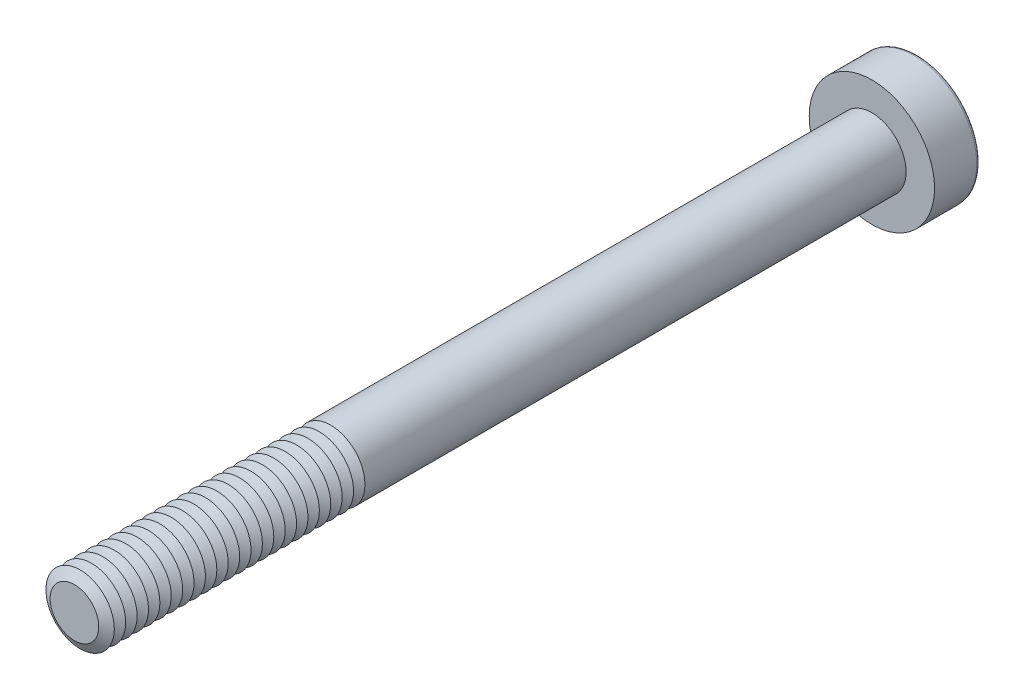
SolidWorks part; units mm, degrees
ref_plane "Front Plane" through (0, 0, 0) normal (0, 0, 1) x (1, 0, 0)
ref_plane "Top Plane" through (0, 0, 0) normal (0, 1, 0) x (1, 0, 0)
ref_plane "Right Plane" through (0, 0, 0) normal (1, 0, 0) x (0, 0, -1)
sketch "Sketch1" plane through (0, 0, 0) normal (0, 0, 1) x (1, 0, 0)
  circle A0 centre (0, 0) radius 1.5
  dimension "D1" = 3
extrude "Boss-Extrude1" add sketch "Sketch1" along normal blind 35
sketch "Sketch2" plane through (0, 0, 0) normal (0, 0, -1) x (-1, 0, 0)
  circle A0 centre (0, 0) radius 2.75
  dimension "D1" = 5.5
extrude "Boss-Extrude2" add sketch "Sketch2" along normal blind 2
sketch "Sketch3" plane through (0, 0, -2) normal (0, 0, -1) x (-1, 0, 0)
  line L1 (-0.5774, 1) -> (-1.1547, 0)
  line L2 (-1.1547, 0) -> (-0.5774, -1)
  line L3 (-0.5774, -1) -> (0.5774, -1)
  line L4 (0.5774, -1) -> (1.1547, 0)
  line L5 (1.1547, 0) -> (0.5774, 1)
  line L6 (0.5774, 1) -> (-0.5774, 1)
  circle A0 centre (0, 0) radius 1 construction
  dimension "D1" = 2
extrude "Cut-Extrude1" cut sketch "Sketch3" against normal blind 1.5
fillet "Fillet1" radius 0.15 1 edges at (-2.75, 0, -2)
sketch "Sketch4" plane through (0, 0, -0.5) normal (0, 0, -1) x (-1, 0, 0)
  line L0 (0.5774, -1) -> (1.1547, 0) construction
  circle A0 centre (0, 0) radius 1
extrude "Cut-Extrude2" cut sketch "Sketch4" against normal through all draft 60
sketch "Sketch5" plane through (0, 0, -2) normal (0, 0, -1) x (-1, 0, 0)
  circle A0 centre (0, 0) radius 1.1547
extrude "Cut-Extrude3" cut sketch "Sketch5" against normal through all draft 75
sketch "Sketch7" plane through (0, 0, 0) normal (1, 0, 0) x (0, 0, -1)
  line L25 (-35, 1.067) -> (-34.75, 1.5)
  line L26 (-35, 1.5) -> (-35, -1.5) construction
  line L27 (-34.75, 1.5) -> (-35.25, 1.5)
  line L28 (-35.25, 1.5) -> (-35, 1.067)
  line L29 (0, 1.5) -> (-35, 1.5) construction
  dimension "D1" = 0.5
revolve "Cut-Revolve1" cut sketch "Sketch7" angle 360 about axis through (0, 0, 35) along (0, 0, -1)
pattern_linear "LPattern1" count 23 spacing 0.5 along (0, 0, -1) of "Cut-Revolve1"
